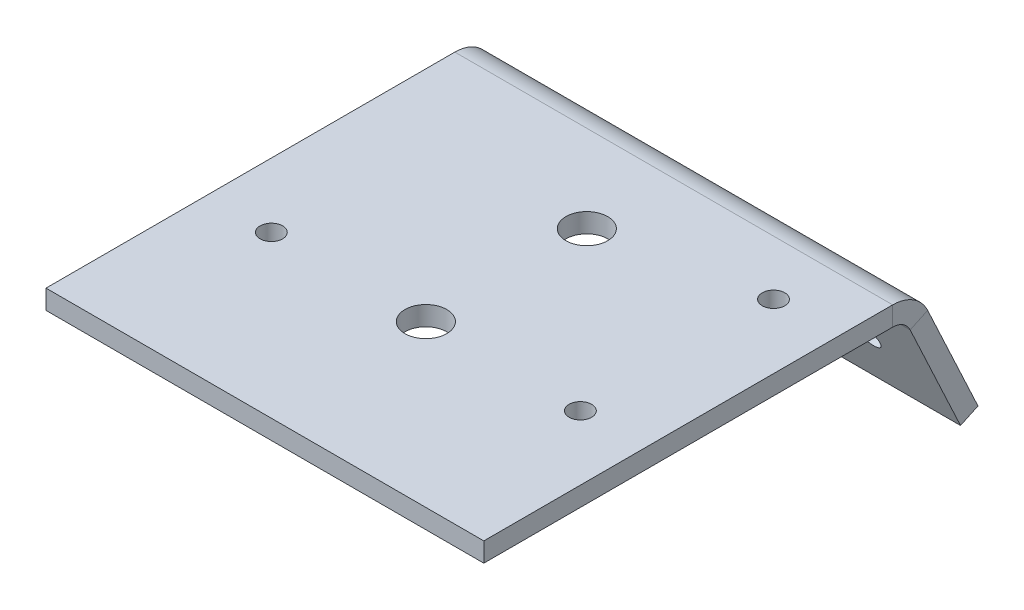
SolidWorks part; units mm, degrees
ref_plane "Front" through (0, 0, 0) normal (0, 0, 1) x (1, 0, 0)
ref_plane "Top" through (0, 0, 0) normal (0, 1, 0) x (1, 0, 0)
ref_plane "Right" through (0, 0, 0) normal (1, 0, 0) x (0, 0, -1)
sketch "Sketch1" plane through (0, 0, 0) normal (0, 1, 0) x (1, 0, 0)
  line L1 (0, 0) -> (68, 0)
  line L2 (0, 0) -> (0, 85)
  line L3 (0, 85) -> (68, 85)
  line L4 (68, 0) -> (68, 85)
  circle A0 centre (10, 75) radius 1.75
  circle A1 centre (58, 75) radius 1.75
  circle A2 centre (10, 25) radius 1.75
  circle A3 centre (58, 25) radius 1.75
  circle A4 centre (58, 55) radius 1.75
  circle A5 centre (34, 25) radius 3.25
  circle A6 centre (34, 50) radius 3.25
extrude "Extrude1" add sketch "Sketch1" along normal blind 3
sheet metal parameters "Sheet-Metal1" parameters "D1"=3
flatten bends "Flatten-Bends1" parameters "D1"=0
sketch "Sharp-Sketch1" plane through (0, 3, 0) normal (0, 1, 0) x (-1, 0, 0)
process bends "Process-Bends1" parameters "D1"=0
sketch "Flat-Sketch1" plane through (0, 3, 0) normal (0, 1, 0) x (-1, 0, 0)
sketch "Sketch5" plane through (0, 3, 0) normal (0, 1, 0) x (-1, 0, 0)
  line L1 (0, -65) -> (-68, -65)
sketched bend "Sketched Bend2" parameters "D1"=3
bend "SketchBend2" bend radius 3 bend angle 65 parameters "D5"=1
flat pattern "Flat-Pattern1"
sketch "Bend-Lines1" plane through (0, 0, 0) normal (0, 1, 0) x (-1, 0, 0)
bend of the flat pattern "Flatten-<SketchBend2>1"
